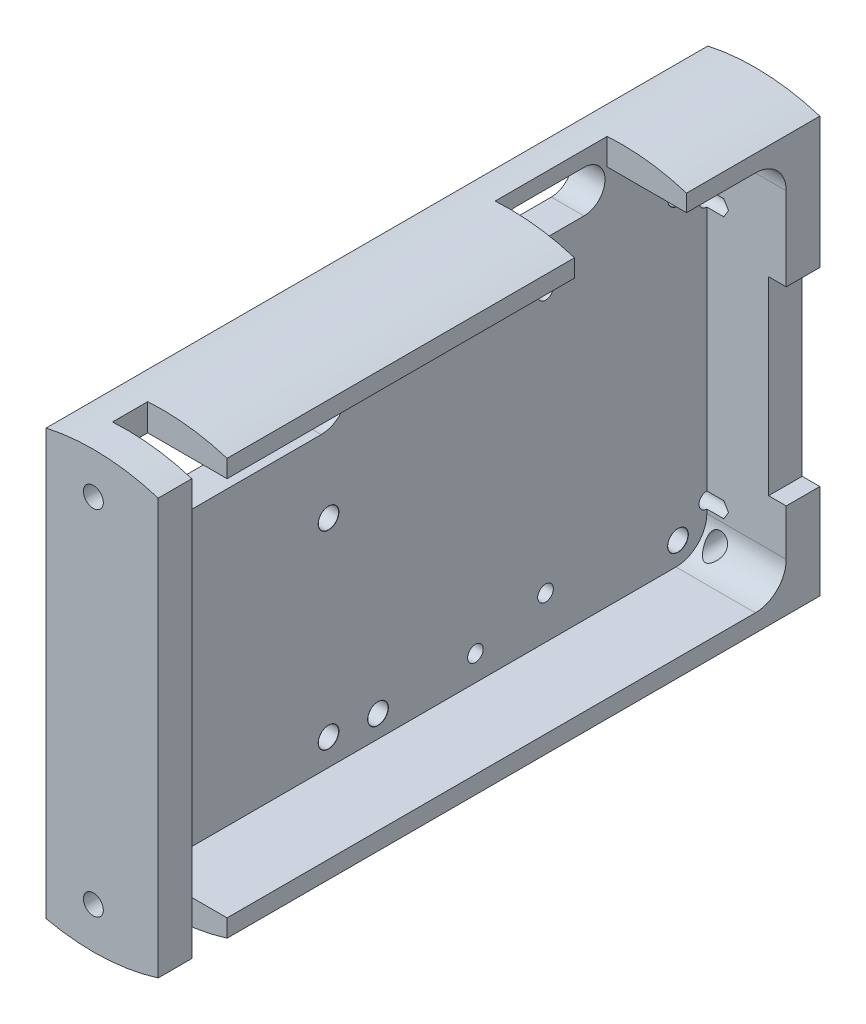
SolidWorks part; units mm, degrees
ref_plane "Front Plane" through (0, 0, 0) normal (0, 0, 1) x (1, 0, 0)
ref_plane "Top Plane" through (0, 0, 0) normal (0, 1, 0) x (1, 0, 0)
ref_plane "Right Plane" through (0, 0, 0) normal (1, 0, 0) x (0, 0, -1)
sketch "Sketch1" plane through (0, 0, 0) normal (1, 0, 0) x (0, 0, -1)
  line L1 (0, 0) -> (75, 0)
  line L2 (0, 0) -> (0, 76.2)
  line L3 (0, 76.2) -> (75, 76.2)
  line L4 (75, 0) -> (75, 76.2)
  dimension "D1" = 76.2
  dimension "D2" = 75
extrude "Boss-Extrude1" add sketch "Sketch1" along normal blind 12.7
sketch "Sketch2" plane through (0, 0, 0) normal (0, 0, 1) x (1, 0, 0)
  line L0 (5.35, 76.2) -> (5.35, 0) construction
  line L3 (12.7, 76.2) -> (12.7, 0) construction
  circle A0 centre (5.35, 38.1) radius 24.675
  dimension "D1" = 49.35
  dimension "D2" = 7.35
extrude "Cut-Extrude1" cut sketch "Sketch2" against normal through all flip side to cut
sketch "Sketch3" plane through (12.7, 0, 0) normal (1, 0, 0) x (0, 0, -1)
  line L0 (71.19, 59.7293) -> (59.89, 59.7293)
  line L1 (7.81, 59.6549) -> (47.19, 59.6549)
  line L2 (3.81, 60.6182) -> (3.81, 15.5818)
  line L3 (7.81, 16.5451) -> (71.19, 16.5451)
  line L4 (71.19, 59.7293) -> (71.19, 16.5451)
  line L6 (0, 61.6549) -> (75, 61.6549) construction
  line L7 (31.19, 57.5151) -> (69.19, 57.5151) construction
  line L8 (31.19, 57.5151) -> (31.19, 19.5151) construction
  line L9 (31.19, 19.5151) -> (69.19, 19.5151) construction
  line L10 (69.19, 57.5151) -> (69.19, 19.5151) construction
  line L11 (75, 14.5451) -> (0, 14.5451) construction
  line L12 (75, 14.5451) -> (75, 61.6549) construction
  line L15 (47.19, 65.3251) -> (47.19, 59.6549)
  line L18 (0, 61.6549) -> (0, 14.5451) construction
  line L19 (3.81, 15.5818) -> (3.81, 8.3996)
  line L20 (3.81, 8.3996) -> (7.81, 8.3996)
  line L21 (7.81, 8.3996) -> (7.81, 16.5451)
  line L22 (3.81, 60.6182) -> (3.81, 67.6658)
  line L23 (3.81, 67.6658) -> (7.81, 67.6658)
  line L24 (7.81, 67.6658) -> (7.81, 59.6549)
  line L25 (59.89, 59.7293) -> (59.89, 65.3251)
  line L26 (59.89, 65.3251) -> (47.19, 65.3251)
  circle A0 centre (69.19, 19.5151) radius 1.7 construction
  circle A1 centre (69.19, 57.5151) radius 1.7 construction
  circle A2 centre (31.19, 57.5151) radius 1.7 construction
  circle A3 centre (31.19, 19.5151) radius 1.7 construction
  point P20 (5.81, 8.3996)
  dimension "D8" = 3.4
  dimension "D1" = 38
  dimension "D2" = 38
  dimension "D3" = 2
  dimension "D4" = 2
  dimension "D5" = 3.81
  dimension "D6" = 2
  dimension "D7" = 2.97
  dimension "D10" = 3.81
  dimension "D11" = 2
  dimension "D12" = 22
  dimension "D13" = 12.7
extrude "Cut-Extrude2" cut sketch "Sketch3" against normal blind 9
sketch "Sketch5" plane through (3.7, 0, 0) normal (1, 0, 0) x (0, 0, -1)
  line L1 (69.92, 17.0451) -> (31.92, 17.0451) construction
  line L2 (69.92, 17.0451) -> (69.92, 55.0451) construction
  line L3 (69.92, 55.0451) -> (31.92, 55.0451) construction
  line L4 (31.92, 17.0451) -> (31.92, 55.0451) construction
  line L11 (67.92, 53.0451) -> (69.92, 53.0451) construction
  line L13 (33.92, 53.0451) -> (31.92, 53.0451) construction
  line L15 (67.92, 53.0451) -> (67.92, 55.0451) construction
  line L17 (67.92, 19.0451) -> (67.92, 17.0451) construction
  line L20 (71.19, 16.5451) -> (71.19, 59.7293) construction
  line L21 (7.81, 16.5451) -> (71.19, 16.5451) construction
  line L22 (3.81, 62.7198) -> (3.81, 13.4802) construction
  line L23 (7.81, 16.5451) -> (71.19, 16.5451) construction
  circle A0 centre (33.92, 53.0451) radius 1
  circle A1 centre (67.92, 53.0451) radius 1
  circle A2 centre (33.92, 19.0451) radius 1
  circle A3 centre (67.92, 19.0451) radius 1
  circle A4 centre (6.81, 41.0451) radius 1.1
  circle A5 centre (28.31, 41.0451) radius 1.1
  circle A6 centre (6.81, 19.5451) radius 1.1
  circle A7 centre (28.31, 19.5451) radius 1.1
  point P4 (33.92, 53.0451)
  point P6 (67.92, 53.0451)
  point P8 (33.92, 19.0451)
  point P10 (67.92, 19.0451)
  point P27 (6.81, 41.0451)
  point P29 (28.31, 41.0451)
  point P31 (6.81, 19.5451)
  point P33 (28.31, 19.5451)
  dimension "D5" = 21.5
  dimension "D6" = 2.2
  dimension "D7" = 1.27
  dimension "D1" = 38
  dimension "D2" = 38
  dimension "D3" = 34
  dimension "D4" = 21.5
  dimension "D8" = 0.5
  dimension "D9" = 3
  dimension "D10" = 34
  dimension "D11" = 3
hole_wizard "Tap Drill for M2.2 Helicoil2" positions "Sketch5" profile "Sketch6" hole size "M2.2x0.45" standard "ANSI Metric"
sketch "Sketch6" plane through (3.7, 19.5451, -28.31) normal (0, 1, 0) x (0, 0, -1)
  line L0 (0, 0) -> (0, 3.7)
  line L1 (0, 3.7) -> (1.15, 3.7)
  line L2 (1.15, 3.7) -> (1.15, 0.0144)
  line L3 (1.15, 0.0144) -> (1.175, 0)
  line L5 (1.175, 0) -> (0, 0)
  line L6 (-1.15, 0.0144) -> (-1.175, 0) construction
  line L11 (0, -6.35) -> (0, 107.95) construction
  dimension "Thru Hole Dia." = 2.3
  dimension "Thru Hole Depth" = 3.7
  dimension "Near C'Sink Dia." = 2.35
  dimension "Near C'Sink Angle" = 120
fillet "Fillet3" radius 3.5 1 edges at (8.2, 59.7293, -71.19)
fillet "Fillet4" radius 3.5 1 edges at (8.2, 16.5451, -71.19)
sketch "Sketch7" plane through (0, 0, -75) normal (0, 0, -1) x (-1, 0, 0)
  circle A0 centre (-5.35, 58.1) radius 1.4224
  circle A2 centre (-5.35, 18.1) radius 1.4224
  arc A4 (-12.7, 14.5451) -> (0, 14.012) centre (-5.35, 38.1) ccw construction
  arc A6 (-12.7, 14.5451) -> (-6.3849, 13.4467) centre (-5.35, 38.1) cw construction
  circle A7 centre (-5.35, 58.1) radius 4.064 construction
  circle A8 centre (-5.35, 18.1) radius 4.064 construction
  point P0 (-5.35, 58.1)
  point P4 (-5.35, 18.1)
  dimension "D2" = 20
  dimension "D1" = 20
hole_wizard "#4-40 Tapped Hole1" positions "Sketch7" profile "Sketch8" tap size "#4-40" standard "ANSI Inch"
sketch "Sketch8" plane through (5.35, 58.1, -75) normal (1, 0, 0) x (0, 1, 0)
  line L0 (0, 0) -> (0, 75)
  line L1 (0, 75) -> (1.1303, 75)
  line L2 (1.1303, 75) -> (1.1303, 0)
  line L5 (1.1303, 0) -> (0, 0)
  line L11 (0, -6.35) -> (0, 107.95) construction
  dimension "Thru Tap Drill Dia." = 2.2606
  dimension "Thru Tap Drill Depth" = 75
sketch "Sketch20" plane through (12.7, 0, 0) normal (1, 0, 0) x (0, 0, -1)
  circle A0 centre (67.92, 19.0451) radius 0.4046 construction
  circle A1 centre (67.92, 53.0451) radius 0.3426 construction
sketch "Sketch22" plane through (12.7, 0, 0) normal (1, 0, 0) x (0, 0, -1)
  line L1 (66.5831, 46.7951) -> (78.8371, 46.7951)
  line L2 (66.5831, 46.7951) -> (66.5831, 25.2951)
  line L3 (66.5831, 25.2951) -> (78.8371, 25.2951)
  line L4 (78.8371, 46.7951) -> (78.8371, 25.2951)
  dimension "D1" = 6.25
  dimension "D2" = 6.25
extrude "Cut-Extrude3" cut sketch "Sketch22" against normal blind 2
sketch "Sketch23" plane through (0, 0, 0) normal (-1, 0, 0) x (0, 0, 1)
  line L2 (-44.958, 56.769) -> (-44.958, 19.431)
  line L8 (0, 62.188) -> (0, 14.012) construction
  line L10 (-71.19, 51.0232) -> (-52.902, 51.0232)
  line L11 (-71.19, 51.0232) -> (-71.19, 21.378)
  line L12 (-71.19, 21.378) -> (-52.902, 21.378)
  line L13 (-52.902, 51.0232) -> (-52.902, 21.378)
  line L15 (0, 62.188) -> (-75, 62.188) construction
  line L18 (-75, 14.012) -> (0, 14.012) construction
  line L25 (-48.514, 60.325) -> (-0.254, 60.325) construction
  line L26 (-48.514, 60.325) -> (-48.514, 15.875) construction
  line L27 (-48.514, 15.875) -> (-0.254, 15.875) construction
  line L28 (-0.254, 60.325) -> (-0.254, 15.875) construction
  line L29 (-3.0166, 15.875) -> (-3.0166, 14.012) construction
  line L31 (-2.1511, 60.325) -> (-2.1511, 62.188) construction
  line L36 (-44.958, 19.431) -> (-44.958, 15.875) construction
  line L38 (-44.958, 56.769) -> (-44.958, 60.325) construction
  line L41 (-74.746, 54.5792) -> (-49.346, 54.5792) construction
  line L42 (-74.746, 54.5792) -> (-74.746, 17.822) construction
  line L43 (-74.746, 17.822) -> (-49.346, 17.822) construction
  line L44 (-49.346, 54.5792) -> (-49.346, 17.822) construction
  line L45 (-75, 14.012) -> (-75, 62.188) construction
  point P512 (-6.604, 23.495)
  dimension "D1" = 3.556
  dimension "D2" = 3.556
  dimension "D3" = 6.35
  dimension "D4" = 0.254
  dimension "D5" = 3.81
  dimension "D6" = 7.62
  dimension "D7" = 48.26
  dimension "D8" = 44.45
  dimension "D9" = 0.254
  dimension "D11" = 3.556
  dimension "D12" = 3.556
  dimension "D13" = 3.556
  dimension "D14" = 3.556
hole_wizard "#2-56 Tapped Hole1" positions "Sketch23" profile "Sketch24" tap size "#2-56" standard "ANSI Inch"
sketch "Sketch24" plane through (0, 56.769, -44.958) normal (0, 1, 0) x (0, 0, 1)
  line L0 (0, 0) -> (0, 6.1542)
  line L1 (0, 6.1542) -> (0.889, 5.62)
  line L2 (0.889, 5.62) -> (0.889, 0)
  line L5 (0.889, 0) -> (0, 0)
  line L10 (0, 6.1542) -> (-0.889, 5.62) construction
  line L11 (0, -6.35) -> (0, 107.95) construction
  dimension "Tap Drill Dia." = 1.778
  dimension "Tap Drill Depth" = 5.62
  dimension "Drill Angle" = 118
sketch "Sketch25" plane through (0, 0, 0) normal (-1, 0, 0) x (0, 0, 1)
  line L0 (-53.455, 60.988) -> (-53.455, 62.188) construction
  line L1 (-30.48, 59.6549) -> (-3.81, 59.6549)
  line L2 (-30.48, 59.6549) -> (-30.48, 49.6549)
  line L3 (-30.48, 49.6549) -> (-3.81, 49.6549)
  line L4 (-3.81, 59.6549) -> (-3.81, 49.6549)
  line L5 (-57.265, 60.988) -> (-49.645, 60.988)
  line L7 (-57.265, 56.2255) -> (-49.645, 56.2255)
  line L9 (-19.167, 59.6549) -> (-19.167, 62.188) construction
  line L10 (0, 62.188) -> (-75, 62.188) construction
  line L11 (0, 62.188) -> (0, 14.012) construction
  arc A1 (-57.265, 60.988) -> (-57.265, 56.2255) centre (-57.265, 58.6068) ccw
  arc A2 (-49.645, 56.2255) -> (-49.645, 60.988) centre (-49.645, 58.6068) ccw
  dimension "D1" = 10
  dimension "D2" = 26.67
  dimension "D3" = 7.62
  dimension "D4" = 4.7625
  dimension "D5" = 10.655
  dimension "D6" = 1.2
  dimension "D7" = 3.81
extrude "Cut-Extrude4" cut sketch "Sketch25" against normal blind 10
fillet "Fillet11" radius 3 1 edges at (1.85, 59.6549, -30.48)
fillet "Fillet12" radius 3 1 edges at (1.85, 59.6549, -3.81)
fillet "Fillet13" radius 3 1 edges at (1.85, 49.6549, -3.81)
fillet "Fillet14" radius 3 1 edges at (1.85, 49.6549, -30.48)
ref_plane "Plane1" through (3.7, 62.7198, -47.19) normal (0, -1, 0) x (-1, 0, 0)
